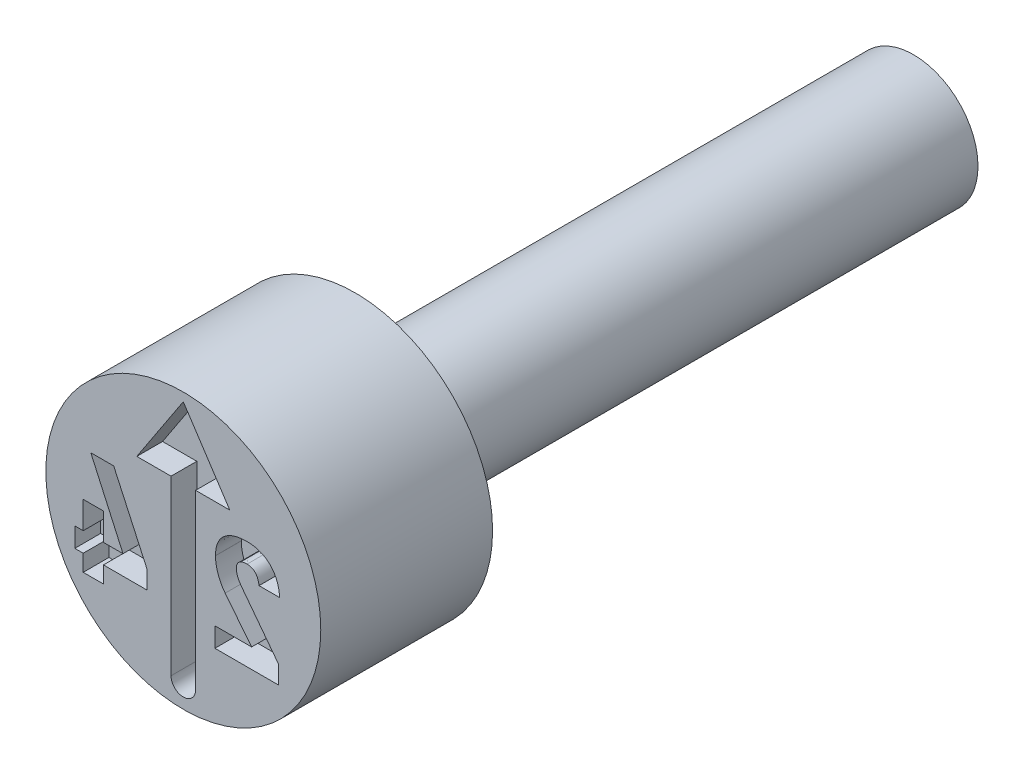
SolidWorks part; units mm, degrees
ref_plane "Front Plane" through (0, 0, 0) normal (0, 0, 1) x (1, 0, 0)
ref_plane "Top Plane" through (0, 0, 0) normal (0, 1, 0) x (1, 0, 0)
ref_plane "Right Plane" through (0, 0, 0) normal (1, 0, 0) x (0, 0, -1)
sketch "Sketch2" plane through (0, 0, 0) normal (1, 0, 0) x (0, 0, -1)
  line L0 (0.4039, 0) -> (50000.4039, 0) construction
  line L6 (0, 3.2) -> (0, 0)
  line L7 (4, 3.2) -> (0, 3.2)
  line L8 (4, 1.5) -> (4, 3.2)
  line L9 (17, 1.5) -> (4, 1.5)
  line L10 (17, 0) -> (17, 1.5)
  line L11 (0, 0) -> (17, 0)
  dimension "D1" = 6.4
  dimension "D2" = 3
  dimension "D3" = 17
  dimension "D4" = 4
revolve "Revolve1" add sketch "Sketch2" angle 360 about L0
sketch "Sketch3" plane through (0, 0, 0) normal (0, 0, 1) x (1, 0, 0)
  line L0 (0, 0) -> (0, 150000) construction
  line L1 (0.2857, 1.3595) -> (0.2857, -2.6642)
  line L2 (1.0829, 1.3595) -> (0.2857, 1.3595)
  line L3 (0, 3.0032) -> (1.0829, 1.3595)
  line L15 (0, 3.0032) -> (-1.0829, 1.3595)
  line L16 (-1.0829, 1.3595) -> (-0.2857, 1.3595)
  line L17 (-0.2857, 1.3595) -> (-0.2857, -2.6642)
  arc A2 (-0.2857, -2.6642) -> (0.2857, -2.6642) centre (0, -2.6642) ccw
extrude "Cut-Extrude4" cut sketch "Sketch3" against normal blind 0.6
sketch "Sketch4" plane through (0, 0, 0) normal (0, 0, 1) x (1, 0, 0)
  text T0 "2  4" font "Bahnschrift" height 2.5
  dimension "D1" = 1.6
  dimension "D2" = 2.4
extrude "Cut-Extrude5" cut sketch "Sketch4" against normal blind 0.6
